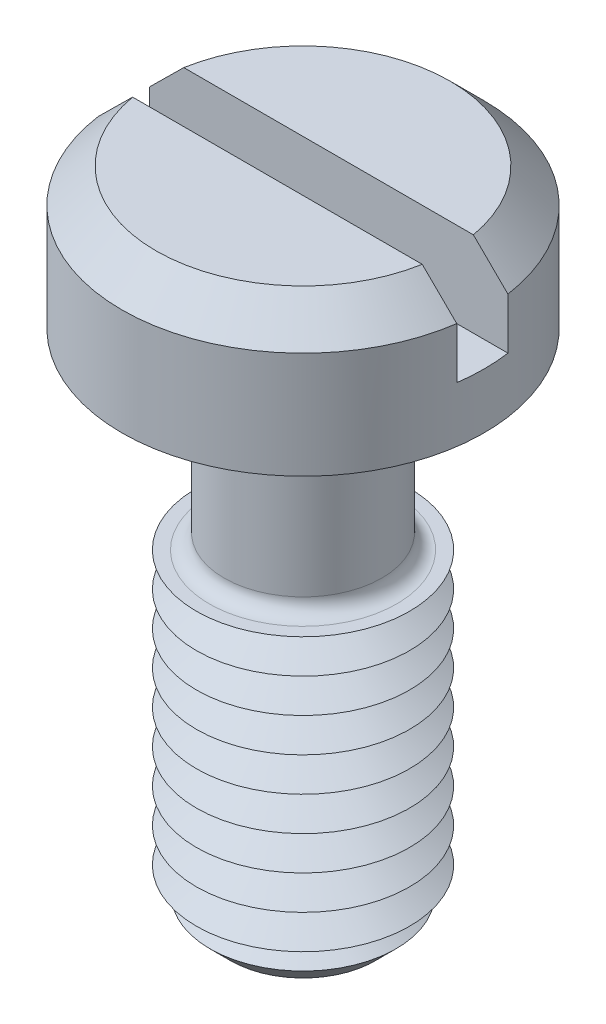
SolidWorks part; units mm, degrees
ref_plane "Front Plane" through (0, 0, 0) normal (0, 0, 1) x (1, 0, 0)
ref_plane "Top Plane" through (0, 0, 0) normal (0, 1, 0) x (1, 0, 0)
ref_plane "Right Plane" through (0, 0, 0) normal (1, 0, 0) x (0, 0, -1)
sketch "Sketch1" plane through (0, 0, 0) normal (0, 1, 0) x (1, 0, 0)
  circle A0 centre (0, 0) radius 4.25
  dimension "D1" = 8.5
extrude "Boss-Extrude1" add sketch "Sketch1" along normal blind 3.3
sketch "Sketch2" plane through (0, 0, 0) normal (0, -1, 0) x (1, 0, 0)
  circle A0 centre (0, 0) radius 1.85
  dimension "D1" = 3.7
extrude "Boss-Extrude2" add sketch "Sketch2" along normal blind 12
sketch "Sketch3" plane through (0, -12, 0) normal (0, -1, 0) x (1, 0, 0)
  circle A0 centre (0, 0) radius 2.5
  dimension "D1" = 5
extrude "Boss-Extrude3" add sketch "Sketch3" against normal blind 7.5
chamfer "Chamfer1" distance 0.8 angle 45 1 edges at (0, -12, -2.5)
sketch "Sketch4" plane through (0, 0, 0) normal (1, 0, 0) x (0, 0, -1)
  line L0 (0, -6.5871) -> (0, -12.0372) construction
sketch "Sketch5" plane through (0, 0, 0) normal (1, 0, 0) x (0, 0, -1)
  line L0 (-2.5, -4.5) -> (-1.8072, -4.9)
  line L1 (-1.8072, -4.9) -> (-2.5, -5.3)
  line L2 (-2.5, -4.5) -> (-2.5, -11.2) construction
  line L3 (-2.5, -5.3) -> (-2.5, -4.5)
  dimension "D1" = 0.8
revolve "Cut-Revolve1" cut sketch "Sketch5" angle 360 about L0
pattern_linear "LPattern1" count 9 spacing 0.8 along (0, -1, 0) of "Cut-Revolve1"
fillet "Fillet1" radius 0.35 2 edges at (0, -4.5, -1.85) (0, 0, -1.85)
chamfer "Chamfer2" distance 0.8 angle 45 1 edges at (0, 3.3, 4.25)
sketch "Sketch6" plane through (0, 3.3, 0) normal (0, 1, 0) x (1, 0, 0)
  line L1 (4.25, -0.6) -> (-4.25, -0.6)
  line L2 (4.25, -0.6) -> (4.25, 0.6)
  line L3 (4.25, 0.6) -> (-4.25, 0.6)
  line L4 (-4.25, -0.6) -> (-4.25, 0.6)
  line L5 (4.25, -0.6) -> (-4.25, 0.6) construction
  line L6 (4.25, 0.6) -> (-4.25, -0.6) construction
  circle A0 centre (0, 0) radius 4.25 construction
  point P0 (0, 0)
  dimension "D1" = 1.2
extrude "Cut-Extrude1" cut sketch "Sketch6" against normal blind 2
